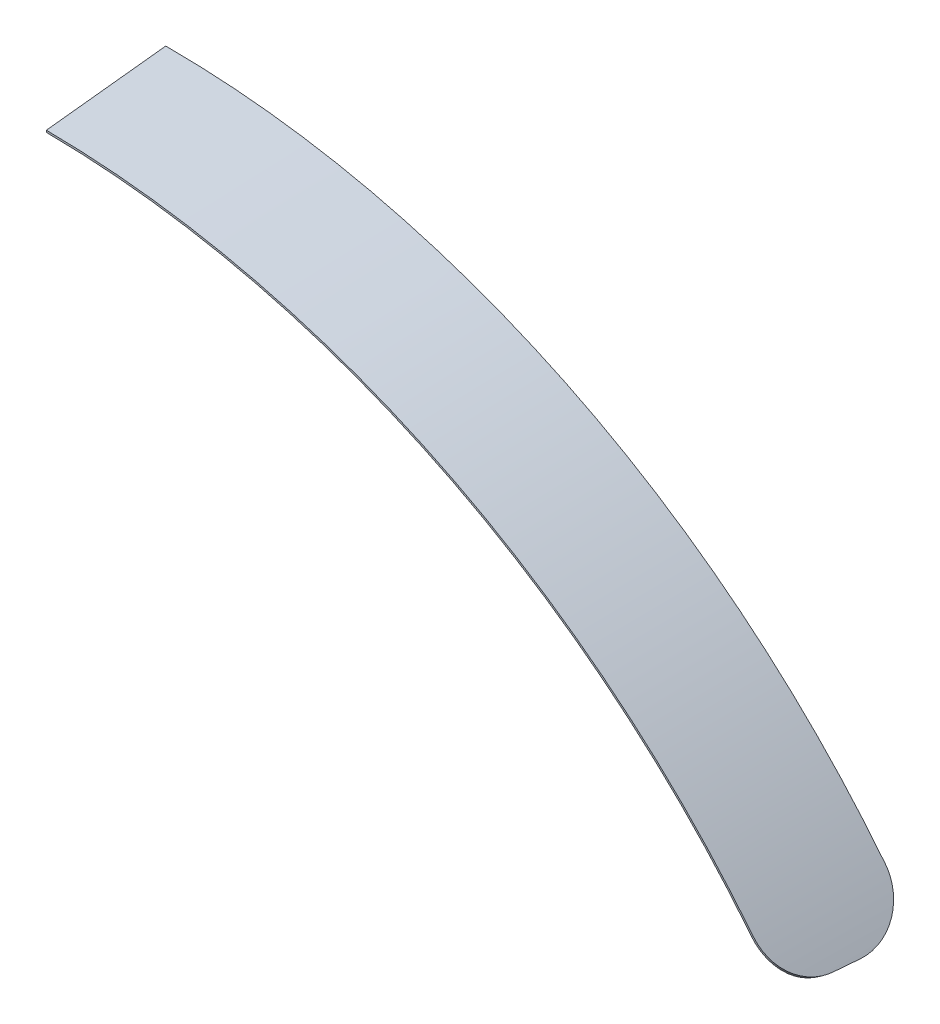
SolidWorks part; units mm, degrees
ref_plane "Plan de face" through (0, 0, 0) normal (0, 0, 1) x (1, 0, 0)
ref_plane "Plan de dessus" through (0, 0, 0) normal (0, 1, 0) x (1, 0, 0)
ref_plane "Plan de droite" through (0, 0, 0) normal (1, 0, 0) x (0, 0, -1)
sketch "Esquisse1" plane through (0, 0, 0) normal (0, 0, 1) x (1, 0, 0)
  line L0 (0, 0) -> (149.0857, 104.3909) construction
  line L1 (0, 0) -> (0, 182) construction
  arc A0 (0, 182) -> (149.0857, 104.3909) centre (0, 0) cw
  dimension "D2" = 182
  dimension "D1" = 55
extrude "Extru.-Mince1" add sketch "Esquisse1" along normal blind 25 draft 3 thin
fillet "Congé1" radius 10 2 edges at (147.1016, 104.6011, 25) (147.8569, 103.5305, 0)
